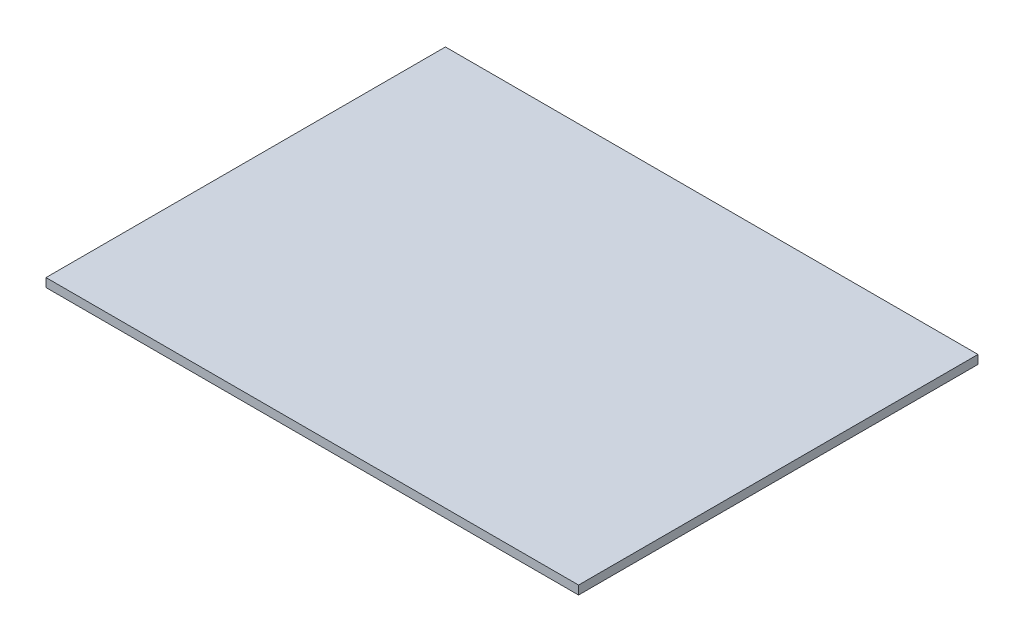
SolidWorks part; units mm, degrees
ref_plane "Front Plane" through (0, 0, 0) normal (0, 0, 1) x (1, 0, 0)
ref_plane "Top Plane" through (0, 0, 0) normal (0, 1, 0) x (1, 0, 0)
ref_plane "Right Plane" through (0, 0, 0) normal (1, 0, 0) x (0, 0, -1)
sketch "Sketch2" plane through (0, 0, 0) normal (0, 1, 0) x (1, 0, 0)
  line L1 (-584.2, 438.15) -> (584.2, 438.15)
  line L2 (-584.2, 438.15) -> (-584.2, -438.15)
  line L3 (-584.2, -438.15) -> (584.2, -438.15)
  line L4 (584.2, 438.15) -> (584.2, -438.15)
  line L5 (-584.2, 438.15) -> (584.2, -438.15) construction
  line L6 (-584.2, -438.15) -> (584.2, 438.15) construction
  point P0 (0, 0)
extrude "Boss-Extrude1" add sketch "Sketch2" along normal blind 19.05
equation "\"system_width\"= 7ft + 10 "
equation "\"system_length\"= 95.5"
equation "\"module_board_length\"= 11.25in"
equation "\"module_board_width\"= 1.5in"
equation "\"step_board_length\"= 5.5in"
equation "\"step_board_width\"= 1.5in"
equation "\"module_lip_width\"= 1.5in"
equation "\"module_trim_thickness\"= 1in"
equation "\"module_width\"= (\"system_width\" -  2* \"module_trim_thickness\") / 2"
equation "\"module_board_short_depth\"= \"module_width\" - ( 2 * \"module_board_width\" ) - \"module_lip_width\""
equation "\"module_board_hole\"= 0.5in"
equation "\"module_board_hole_seperation\"= 20in"
equation "\"system_step_length\"= 2ft+11.5"
equation "\"system_top_length\"= \"system_length\" - \"system_step_length\""
equation "\"module_top_thickness\"= 0.75in"
equation "\"module_trim_height\"= 14in"
equation "\"module_top_overhang\"= 4.5in"
equation "\"module_trim_angle\"= 45deg"
equation "\"module_length\"= (\"system_top_length\" - \"module_trim_thickness\")/ 2"
equation "\"module_board_long_depth\"= \"module_length\" - \"module_lip_width\""
equation "\"module_board_hole_position\"= ( ( \"module_width\" - \"module_board_hole_seperation\" ) / 2 ) + \"module_board_width\"/2"
equation "\"step_module_width\"= \"module_width\""
equation "\"step_module_length\"= \"system_step_length\" - \"module_trim_thickness\""
equation "\"step_board_short_depth\"= \"step_module_length\" - \"module_lip_width\""
equation "\"step_board_long_depth\"= \"step_module_width\" - (2 * \"module_board_width\") - \"module_lip_width\""
equation "\"step_trim_height\"= 8in"
equation "\"D1@Sketch2\"=\"step_module_width\""
equation "\"D2@Sketch2\"=\"step_module_length\""
equation "\"D1@Boss-Extrude1\"=\"module_top_thickness\""
